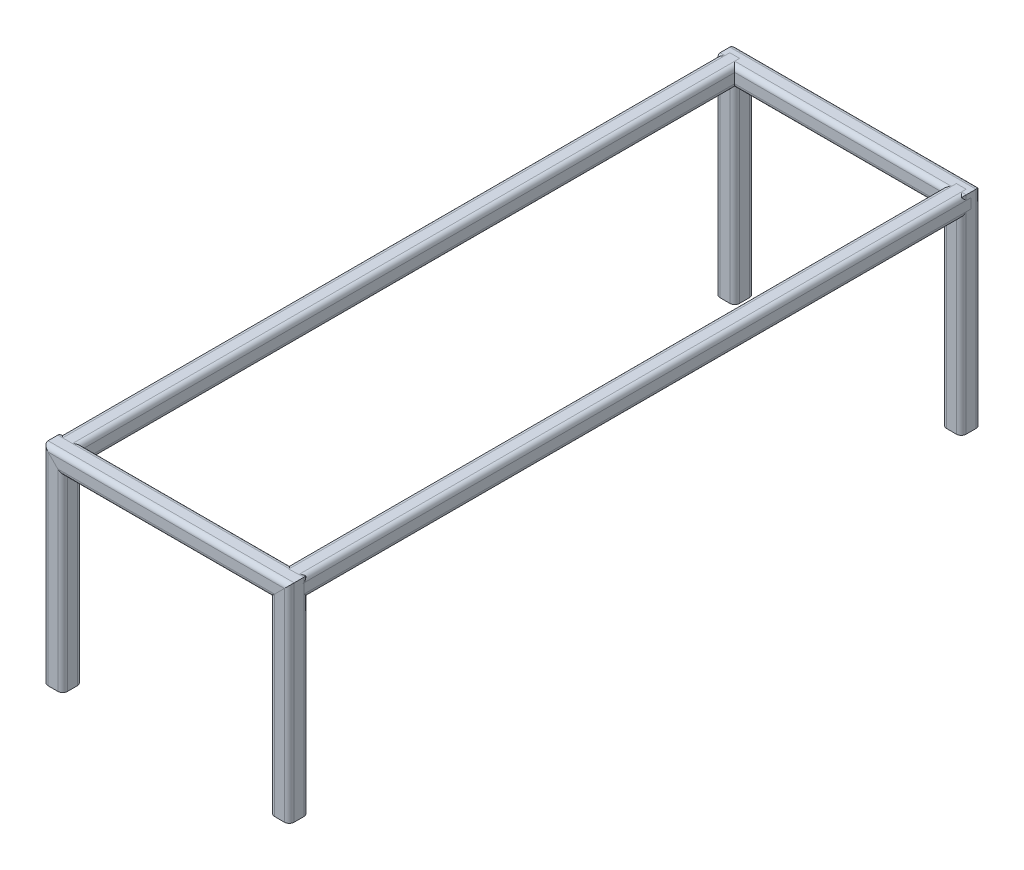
SolidWorks part; units mm, degrees
ref_plane "Front Plane" through (0, 0, 0) normal (0, 0, 1) x (1, 0, 0)
ref_plane "Top Plane" through (0, 0, 0) normal (0, 1, 0) x (1, 0, 0)
ref_plane "Right Plane" through (0, 0, 0) normal (1, 0, 0) x (0, 0, -1)
sketch3d "3DSketch1"
  line L0 (588.6395, 513.1775, 0) -> (588.6395, 513.1775, -1745.8203)
  line L1 (0, 0, 0) -> (588.6395, 0, 0)
  line L2 (0, 0, 0) -> (0, 513.1775, 0)
  line L3 (0, 513.1775, 0) -> (588.6395, 513.1775, 0)
  line L4 (588.6395, 0, 0) -> (588.6395, 513.1775, 0)
  line L5 (0, 513.1775, 0) -> (0, 513.1775, -1745.8203)
  line L6 (588.6395, 513.1775, -1745.8203) -> (0, 513.1775, -1745.8203)
  line L7 (588.6395, 513.1775, -1745.8203) -> (588.6395, 0, -1745.8203)
  line L8 (588.6395, 0, -1745.8203) -> (0, 0, -1745.8203)
  line L9 (0, 513.1775, -1745.8203) -> (0, 0, -1745.8203)
other "Structural Member1"
ref_plane "Plane3" through (0, 0, 0) normal (0, 1, 0) x (1, 0, 0)
sketch "Sketch1" plane through (0, 0, 0) normal (0, 1, 0) x (1, 0, 0)
  line L0 (-12.7, -19.05) -> (12.7, -19.05)
  line L1 (-19.05, -12.7) -> (-19.05, 12.7)
  line L2 (12.7, 19.05) -> (-12.7, 19.05)
  line L3 (19.05, 12.7) -> (19.05, -12.7)
  line L4 (-12.7, -25.4) -> (12.7, -25.4)
  line L5 (-25.4, -12.7) -> (-25.4, 12.7)
  line L6 (12.7, 25.4) -> (-12.7, 25.4)
  line L7 (25.4, 12.7) -> (25.4, -12.7)
  line L8 (0, 0) -> (19.05, 0) construction
  line L9 (0, 0) -> (0, 19.05) construction
  arc A0 (25.4, 12.7) -> (12.7, 25.4) centre (12.7, 12.7) ccw
  arc A1 (12.7, -25.4) -> (25.4, -12.7) centre (12.7, -12.7) ccw
  arc A2 (-25.4, -12.7) -> (-12.7, -25.4) centre (-12.7, -12.7) ccw
  arc A3 (-12.7, 25.4) -> (-25.4, 12.7) centre (-12.7, 12.7) ccw
  arc A4 (-12.7, 19.05) -> (-19.05, 12.7) centre (-12.7, 12.7) ccw
  arc A5 (19.05, 12.7) -> (12.7, 19.05) centre (12.7, 12.7) ccw
  arc A6 (12.7, -19.05) -> (19.05, -12.7) centre (12.7, -12.7) ccw
  arc A7 (-19.05, -12.7) -> (-12.7, -19.05) centre (-12.7, -12.7) ccw
  point P3 (0, 25.4)
  point P4 (25.4, 0)
  point P5 (0, -25.4)
  point P6 (-25.4, 0)
  point P7 (-25.4, 25.4)
  point P8 (-25.4, -25.4)
  point P33 (0, 0)
  point P35 (25.4, -25.4)
  point P36 (25.4, 25.4)
  point P37 (0, 0)
  dimension "D1" = 12.7
  dimension "Thickness" = 6.35
  dimension "V_leg" = 50.8
other "Structural Member2"
ref_plane "Plane4" through (0, 513.1775, 0) normal (0, 0, -1) x (1, 0, 0)
sketch "Sketch12" plane through (0, 513.1775, 0) normal (0, 0, -1) x (1, 0, 0)
  line L0 (-12.7, -19.05) -> (12.7, -19.05)
  line L1 (-19.05, -12.7) -> (-19.05, 12.7)
  line L2 (12.7, 19.05) -> (-12.7, 19.05)
  line L3 (19.05, 12.7) -> (19.05, -12.7)
  line L4 (-12.7, -25.4) -> (12.7, -25.4)
  line L5 (-25.4, -12.7) -> (-25.4, 12.7)
  line L6 (12.7, 25.4) -> (-12.7, 25.4)
  line L7 (25.4, 12.7) -> (25.4, -12.7)
  line L8 (0, 0) -> (19.05, 0) construction
  line L9 (0, 0) -> (0, 19.05) construction
  arc A0 (25.4, 12.7) -> (12.7, 25.4) centre (12.7, 12.7) ccw
  arc A1 (12.7, -25.4) -> (25.4, -12.7) centre (12.7, -12.7) ccw
  arc A2 (-25.4, -12.7) -> (-12.7, -25.4) centre (-12.7, -12.7) ccw
  arc A3 (-12.7, 25.4) -> (-25.4, 12.7) centre (-12.7, 12.7) ccw
  arc A4 (-12.7, 19.05) -> (-19.05, 12.7) centre (-12.7, 12.7) ccw
  arc A5 (19.05, 12.7) -> (12.7, 19.05) centre (12.7, 12.7) ccw
  arc A6 (12.7, -19.05) -> (19.05, -12.7) centre (12.7, -12.7) ccw
  arc A7 (-19.05, -12.7) -> (-12.7, -19.05) centre (-12.7, -12.7) ccw
  point P3 (0, 25.4)
  point P4 (25.4, 0)
  point P5 (0, -25.4)
  point P6 (-25.4, 0)
  point P7 (-25.4, 25.4)
  point P8 (-25.4, -25.4)
  point P33 (0, 0)
  point P35 (25.4, -25.4)
  point P36 (25.4, 25.4)
  point P37 (0, 0)
  dimension "D1" = 12.7
  dimension "Thickness" = 6.35
  dimension "V_leg" = 50.8
